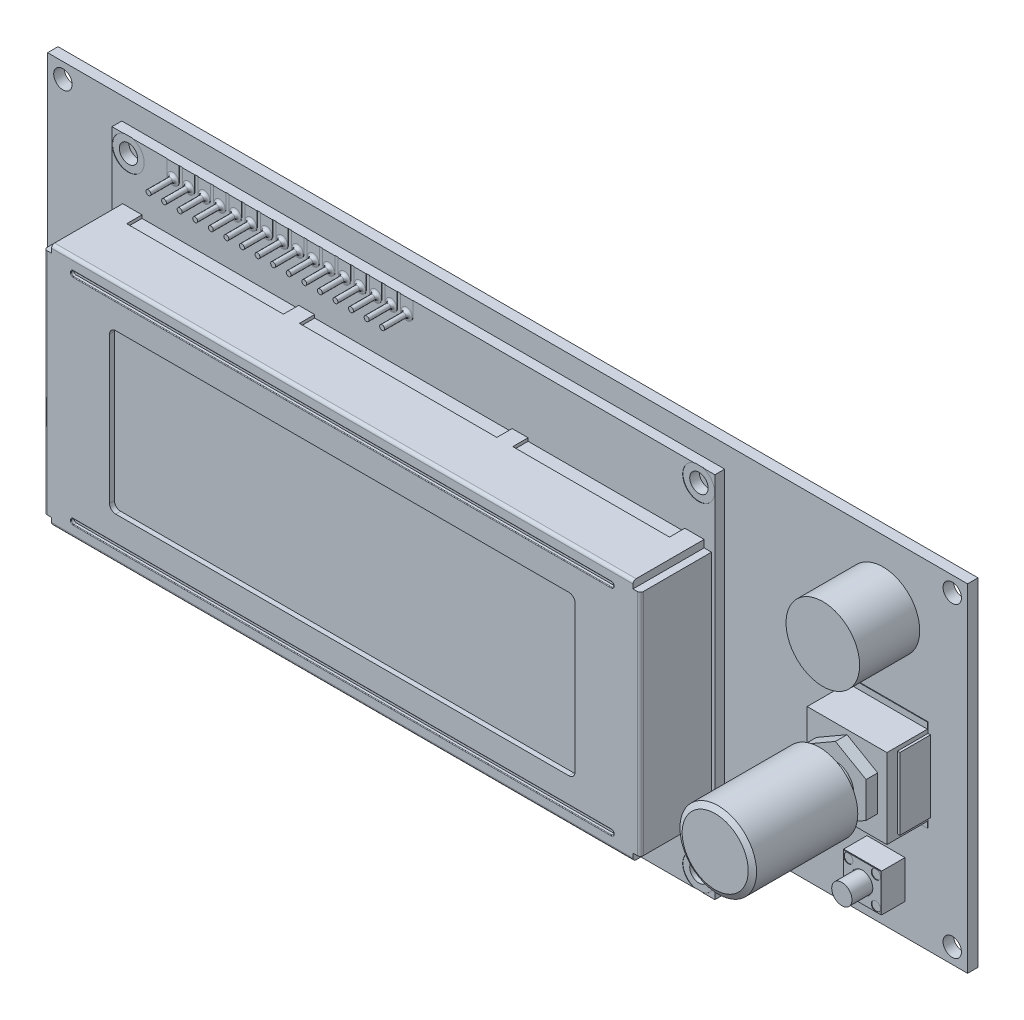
SolidWorks part; units mm, degrees
ref_plane "Front Plane" through (0, 0, 0) normal (0, 0, 1) x (1, 0, 0)
ref_plane "Top Plane" through (0, 0, 0) normal (0, 1, 0) x (1, 0, 0)
ref_plane "Right Plane" through (0, 0, 0) normal (1, 0, 0) x (0, 0, -1)
sketch "Sketch1" plane through (0, 0, 0) normal (0, 0, 1) x (1, 0, 0)
  line L1 (-75, 27.5) -> (75, 27.5)
  line L2 (-75, 27.5) -> (-75, -27.5)
  line L3 (-75, -27.5) -> (75, -27.5)
  line L4 (75, 27.5) -> (75, -27.5)
  line L5 (-75, 27.5) -> (75, -27.5) construction
  line L6 (-75, -27.5) -> (75, 27.5) construction
  point P0 (0, 0)
  dimension "D1" = 150
  dimension "D2" = 55
extrude "Boss-Extrude1" add sketch "Sketch1" against normal blind 1.7
sketch "Sketch2" plane through (0, 0, -1.7) normal (0, 0, -1) x (-1, 0, 0)
  line L1 (-72.5, 25) -> (72.5, 25) construction
  line L2 (-72.5, 25) -> (-72.5, -25) construction
  line L3 (-72.5, -25) -> (72.5, -25) construction
  line L4 (72.5, 25) -> (72.5, -25) construction
  line L5 (-72.5, 25) -> (72.5, -25) construction
  line L6 (-72.5, -25) -> (72.5, 25) construction
  circle A0 centre (-72.5, 25) radius 1.5
  circle A1 centre (72.5, 25) radius 1.5
  circle A2 centre (72.5, -25) radius 1.5
  circle A3 centre (-72.5, -25) radius 1.5
  point P0 (0, 0)
  dimension "D3" = 3
  dimension "D1" = 50
  dimension "D2" = 145
extrude "Cut-Extrude1" cut sketch "Sketch2" against normal through all
ref_plane "Plane1" through (0, 0, 2.5) normal (0, 0, 1) x (1, 0, 0)
sketch "Sketch4" plane through (0, 0, 2.5) normal (0, 0, 1) x (1, 0, 0)
  line L0 (-75, 27.5) -> (-75, -27.5) construction
  line L1 (-62, 24.8) -> (36.3, 24.8)
  line L2 (-62, 24.8) -> (-62, -35.2)
  line L3 (-62, -35.2) -> (36.3, -35.2)
  line L4 (36.3, 24.8) -> (36.3, -35.2)
  line L5 (75, 27.5) -> (-75, 27.5) construction
  dimension "D1" = 60
  dimension "D2" = 98.3
  dimension "D3" = 13
  dimension "D4" = 2.7
extrude "Boss-Extrude2" add sketch "Sketch4" against normal blind 1.6 separate body
sketch "Sketch3" plane through (0, 0, 0) normal (0, 0, 1) x (1, 0, 0)
  line L0 (-75, 27.5) -> (-75, -27.5) construction
  line L1 (-53, 22.75) -> (-12.6, 22.75)
  line L2 (-53, 22.75) -> (-53, 21.25)
  line L3 (-53, 21.25) -> (-12.6, 21.25)
  line L4 (-12.6, 22.75) -> (-12.6, 21.25)
  line L5 (75, 27.5) -> (-75, 27.5) construction
  line L6 (-53, 22) -> (-12.6, 22) construction
  dimension "D1" = 22
  dimension "D2" = 4.75
  dimension "D3" = 5.5
  dimension "D4" = 40.4
extrude "Boss-Extrude3" add sketch "Sketch3" along normal up to next
sketch "Sketch5" plane through (0, 0, 2.5) normal (0, 0, 1) x (1, 0, 0)
  line L0 (-59.35, -5.2) -> (-62, -5.2) construction
  line L1 (-59.35, 22.3) -> (33.65, 22.3) construction
  line L2 (-59.35, 22.3) -> (-59.35, -32.7) construction
  line L3 (-59.35, -32.7) -> (33.65, -32.7) construction
  line L4 (33.65, 22.3) -> (33.65, -32.7) construction
  line L5 (-62, 24.8) -> (-62, -35.2) construction
  line L6 (-12.85, 22.3) -> (-12.85, 24.8) construction
  line L7 (36.3, 24.8) -> (-62, 24.8) construction
  circle A0 centre (-59.35, 22.3) radius 1.5
  circle A1 centre (33.65, 22.3) radius 1.5
  circle A2 centre (33.65, -32.7) radius 1.5
  circle A3 centre (-59.35, -32.7) radius 1.5
  dimension "D3" = 3
  dimension "D1" = 55
  dimension "D2" = 93
extrude "Cut-Extrude2" cut sketch "Sketch5" against normal up to next
ref_plane "Plane2" through (0, 0, 14.1) normal (0, 0, -1) x (-1, 0, 0)
sketch "Sketch6" plane through (0, 0, 2.5) normal (0, 0, 1) x (1, 0, 0)
  line L0 (-12.85, 14.8) -> (-12.85, 24.8) construction
  line L1 (-61.45, 14.8) -> (35.75, 14.8) construction
  line L2 (-61.45, 14.8) -> (-61.45, -24.9) construction
  line L3 (-61.45, -24.9) -> (35.75, -24.9) construction
  line L4 (35.75, 14.8) -> (35.75, -24.9) construction
  line L5 (36.3, 24.8) -> (-62, 24.8) construction
  line L6 (-61.45, 13.6) -> (-60.25, 13.6)
  line L7 (-60.25, 13.6) -> (-60.25, 14.8)
  line L8 (-60.25, -24.9) -> (-60.25, -23.7)
  line L9 (-60.25, -23.7) -> (-61.45, -23.7)
  line L10 (34.55, -24.9) -> (34.55, -23.7)
  line L11 (34.55, -23.7) -> (35.75, -23.7)
  line L12 (35.75, 13.6) -> (34.55, 13.6)
  line L13 (34.55, 13.6) -> (34.55, 14.8)
  line L14 (35.75, 13.6) -> (35.75, -23.7)
  line L15 (34.55, -24.9) -> (-60.25, -24.9)
  line L16 (-61.45, -23.7) -> (-61.45, 13.6)
  line L17 (-60.25, 14.8) -> (34.55, 14.8)
  dimension "D1" = 97.2
  dimension "D2" = 39.7
  dimension "D3" = 10
  dimension "D4" = 1.2
extrude "Boss-Extrude4" add sketch "Sketch6" along normal up to surface (11.6 mm away)
sketch "Sketch7" plane through (0, 0, 14.1) normal (0, 0, 1) x (1, 0, 0)
  line L0 (-12.85, 7.9) -> (-12.85, 14.8) construction
  line L1 (-50.8, 7.9) -> (25.1, 7.9)
  line L2 (-50.8, 7.9) -> (-50.8, -18)
  line L3 (-50.8, -18) -> (25.1, -18)
  line L4 (25.1, 7.9) -> (25.1, -18)
  line L5 (34.55, 14.8) -> (-60.25, 14.8) construction
  line L6 (25.1, -5.05) -> (35.75, -5.05) construction
  line L7 (35.75, 13.6) -> (35.75, -23.7) construction
  dimension "D1" = 25.9
  dimension "D2" = 75.9
extrude "Cut-Extrude3" cut sketch "Sketch7" against normal blind 0.8
fillet "Fillet1" radius 1 4 edges at (25.1, -18, 13.7) (-50.8, 7.9, 13.7) (-50.8, -18, 13.7) (25.1, 7.9, 13.7)
fillet "Fillet2" radius 0.5 4 edges at (-61.45, -5.05, 14.1) (-12.85, -24.9, 14.1) (-12.85, 14.8, 14.1) (35.75, -5.05, 14.1)
sketch "Sketch8" plane through (0, 0, 14.1) normal (0, 0, 1) x (1, 0, 0)
  line L0 (-12.85, -22.95) -> (-12.85, -24.4) construction
  line L1 (-57.1, 12.85) -> (31.4, 12.85)
  line L2 (-57.1, 12.85) -> (-57.1, 12.05)
  line L3 (-57.1, 12.05) -> (31.4, 12.05)
  line L4 (31.4, 12.85) -> (31.4, 12.05)
  line L5 (-57.1, -22.15) -> (31.4, -22.15)
  line L6 (-57.1, -22.15) -> (-57.1, -22.95)
  line L7 (-57.1, -22.95) -> (31.4, -22.95)
  line L8 (31.4, -22.15) -> (31.4, -22.95)
  line L9 (-60.25, -24.4) -> (34.55, -24.4) construction
  line L10 (-12.85, 12.05) -> (-12.85, -22.15) construction
  line L11 (-12.85, -5.05) -> (25.1, -5.05) construction
  line L12 (25.1, -17) -> (25.1, 6.9) construction
  dimension "D1" = 0.8
  dimension "D2" = 88.5
  dimension "D3" = 35
extrude "Cut-Extrude4" cut sketch "Sketch8" against normal blind 0.5
fillet "Fillet3" radius 0.4 8 edges at (31.4, 12.05, 13.85) (31.4, 12.85, 13.85) (-57.1, 12.85, 13.85) (-57.1, 12.05, 13.85) (31.4, -22.95, 13.85) (31.4, -22.15, 13.85) (-57.1, -22.95, 13.85) (-57.1, -22.15, 13.85)
fillet "Fillet4" radius 0.1 12 edges at (31.2828, 12.7328, 14.1) (31.2828, 12.1672, 14.1) (-12.85, 12.05, 14.1) (-56.9828, 12.1672, 14.1) (-56.9828, 12.7328, 14.1) (31.2828, -22.2672, 14.1) (31.2828, -22.8328, 14.1) (-12.85, -22.95, 14.1) (-56.9828, -22.8328, 14.1) (-56.9828, -22.2672, 14.1) (-12.85, 12.85, 14.1) (-12.85, -22.15, 14.1)
sketch "Sketch9" plane through (0, -24.9, 0) normal (0, -1, 0) x (1, 0, 0)
  line L0 (-62, 2.5) -> (36.3, 2.5) construction
  line L1 (-57.1, 2.5) -> (-31.55, 2.5)
  line L2 (-57.1, 2.5) -> (-57.1, 5)
  line L3 (-57.1, 5) -> (-31.55, 5)
  line L4 (-31.55, 2.5) -> (-31.55, 5)
  line L5 (-12.85, 5) -> (-12.85, 13.6) construction
  line L6 (-28.95, 2.5) -> (3.25, 2.5)
  line L7 (-28.95, 2.5) -> (-28.95, 5)
  line L8 (-28.95, 5) -> (3.25, 5)
  line L9 (3.25, 2.5) -> (3.25, 5)
  line L10 (5.85, 2.5) -> (31.4, 2.5)
  line L11 (5.85, 2.5) -> (5.85, 5)
  line L12 (5.85, 5) -> (31.4, 5)
  line L13 (31.4, 2.5) -> (31.4, 5)
  line L14 (34.55, 13.6) -> (-60.25, 13.6) construction
  line L15 (3.25, 5) -> (5.85, 5) construction
  line L16 (-28.95, 5) -> (-31.55, 5) construction
  dimension "D1" = 2.5
  dimension "D2" = 32.2
  dimension "D3" = 25.55
  dimension "D4" = 88.5
extrude "Cut-Extrude5" cut sketch "Sketch9" against normal blind 0.5
ref_plane "Plane3" through (0, -5.05, 0) normal (0, 1, 0) x (1, 0, 0)
mirror "Mirror1" about plane through (0, -5.05, 0) normal (0, 1, 0) of "Cut-Extrude5"
sketch "Sketch10" plane through (0, 0, 2.5) normal (0, 0, 1) x (1, 0, 0)
  line L0 (-12.6, 22.75) -> (-53, 22.75) construction
  line L1 (-53, 24.8) -> (-51, 24.8) construction
  line L2 (-53, 24.8) -> (-53, 21.5) construction
  line L3 (-53, 21.5) -> (-51, 21.5) construction
  line L4 (-51, 24.8) -> (-51, 21.5) construction
  line L5 (-12.6, 21.25) -> (-12.6, 22.75) construction
  line L6 (-53, 22.75) -> (-53, 21.25) construction
  line L7 (-53, 21.25) -> (-12.6, 21.25) construction
  line L8 (-12.6, 22.75) -> (-53, 22.75) construction
  line L9 (-12.6, 21.25) -> (-12.6, 22.75) construction
  line L10 (-53, 22.75) -> (-53, 21.25) construction
  line L11 (-53, 21.25) -> (-12.6, 21.25) construction
  line L12 (36.3, 24.8) -> (-62, 24.8) construction
  line L13 (-52, 21.5) -> (-52, 24.8) construction
  line L14 (-62, 24.8) -> (-62, -35.2) construction
  line L15 (-51, 22.5) -> (-51, 24.8)
  line L16 (-51, 24.8) -> (-53, 24.8)
  line L17 (-53, 24.8) -> (-53, 22.5)
  arc A0 (-51, 22.5) -> (-53, 22.5) centre (-52, 22.5) cw
  dimension "D1" = 2
  dimension "D2" = 10
  dimension "D3" = 2.3
extrude "Boss-Extrude5" add sketch "Sketch10" along normal blind 0.05
sketch "Sketch11" plane through (0, 0, 2.55) normal (0, 0, 1) x (1, 0, 0)
  circle A0 centre (-52, 22.5) radius 0.4
  dimension "D1" = 0.8
extrude "Boss-Extrude6" add sketch "Sketch11" along normal blind 4
fillet "Fillet5" radius 0.5 1 edges at (-52.4, 22.5, 2.55)
pattern_linear "LPattern1" count 16 spacing 2.54 along (1, 0, 0) of "Boss-Extrude5", "Boss-Extrude6", "Fillet5"
sketch "Sketch12" plane through (0, 0, 2.5) normal (0, 0, 1) x (1, 0, 0)
  circle A0 centre (-59.35, 22.3) radius 2.6
  circle A1 centre (33.65, 22.3) radius 2.6
  circle A2 centre (33.65, -32.7) radius 2.6
  circle A3 centre (-59.35, -32.7) radius 2.6
  dimension "D1" = 5.2
extrude "Cut-Extrude7" cut sketch "Sketch12" against normal blind 0.05
sketch "Sketch13" plane through (0, 0, 0) normal (0, 0, 1) x (1, 0, 0)
  line L0 (75, 27.5) -> (-75, 27.5) construction
  line L1 (75, -27.5) -> (75, 27.5) construction
  circle A0 centre (61.2, 17) radius 6
  dimension "D1" = 12
  dimension "D2" = 10.5
  dimension "D3" = 13.8
extrude "Boss-Extrude8" add sketch "Sketch13" along normal blind 9.8
sketch "Sketch14" plane through (0, 0, 0) normal (0, 0, 1) x (1, 0, 0)
  line L1 (55.15, 3.15) -> (68.95, 3.15)
  line L2 (55.15, 3.15) -> (55.15, -8.55)
  line L3 (55.15, -8.55) -> (68.95, -8.55)
  line L4 (68.95, 3.15) -> (68.95, -8.55)
  line L6 (55.15, 3.15) -> (68.95, -8.55) construction
  line L7 (55.15, -8.55) -> (68.95, 3.15) construction
  line L8 (75, 27.5) -> (-75, 27.5) construction
  line L9 (75, -27.5) -> (75, 27.5) construction
  point P6 (62.05, -2.7)
  dimension "D1" = 13.8
  dimension "D2" = 12.95
  dimension "D3" = 30.2
  dimension "D4" = 11.7
extrude "Boss-Extrude9" add sketch "Sketch14" along normal blind 5
ref_plane "Plane4" through (62.05, 0, 0) normal (1, 0, 0) x (0, 0, -1)
sketch "Sketch15" plane through (62.05, 0, 0) normal (1, 0, 0) x (0, 0, -1)
  line L0 (0, 3.15) -> (-5, 3.15)
  line L1 (-5, 3.15) -> (0, 3.15) construction
  line L2 (-5, 3.15) -> (-5, -8.55)
  line L3 (-5, -8.55) -> (0, -8.55)
  line L4 (0, -8.55) -> (0, -10.2)
  line L5 (0, -27.5) -> (0, 27.5) construction
  line L6 (0, -10.2) -> (-0.1, -10.2)
  line L7 (-0.1, -10.2) -> (-0.1, -9.2)
  line L8 (-0.1, -9.2) -> (-6.7, -9.2)
  line L9 (-6.7, -9.2) -> (-6.7, 3.8)
  line L10 (-6.7, 3.8) -> (-0.1, 3.8)
  line L11 (-0.1, 3.8) -> (-0.1, 4.8)
  line L12 (-0.1, 4.8) -> (0, 4.8)
  line L13 (0, 4.8) -> (0, 3.15)
  line L14 (-6.7, -2.7) -> (-5, -2.7) construction
  line L15 (1.7, -27.5) -> (1.7, 27.5) construction
  dimension "D1" = 13
  dimension "D2" = 8.4
  dimension "D3" = 0.1
  dimension "D4" = 15
extrude "Boss-Extrude10" add sketch "Sketch15" against normal mid plane 13
sketch "Sketch16" plane through (0, 0, 6.7) normal (0, 0, 1) x (1, 0, 0)
  line L0 (55.55, 3.8) -> (68.55, -9.2) construction
  line L1 (67.05, -5.5868) -> (67.05, 0.1868)
  line L2 (67.05, 0.1868) -> (62.05, 3.0735)
  line L3 (62.05, 3.0735) -> (57.05, 0.1868)
  line L4 (57.05, 0.1868) -> (57.05, -5.5868)
  line L5 (57.05, -5.5868) -> (62.05, -8.4735)
  line L6 (62.05, -8.4735) -> (67.05, -5.5868)
  circle A0 centre (62.05, -2.7) radius 5 construction
  point P12 (62.05, -2.7)
  dimension "D1" = 10
extrude "Boss-Extrude11" add sketch "Sketch16" along normal blind 1.9
sketch "Sketch17" plane through (0, 0, 8.6) normal (0, 0, 1) x (1, 0, 0)
  line L0 (62.05, 3.0735) -> (62.05, -8.4735) construction
  circle A0 centre (62.05, -2.7) radius 3
  point P6 (62.05, -2.7)
  dimension "D1" = 6
extrude "Boss-Extrude12" add sketch "Sketch17" along normal blind 2.6
sketch "Sketch18" plane through (0, 0, 11.2) normal (0, 0, 1) x (1, 0, 0)
  circle A0 centre (62.05, -2.7) radius 6.25
  dimension "D1" = 12.5
extrude "Boss-Extrude13" add sketch "Sketch18" along normal blind 17
chamfer "Chamfer1" distance 0.5 angle 60 1 edges at (68.3, -2.7, 28.2)
sketch "Sketch19" plane through (0, 0, 0) normal (0, 0, 1) x (1, 0, 0)
  line L0 (-75, -27.5) -> (75, -27.5) construction
  line L1 (58.6, -16.25) -> (64.8, -16.25)
  line L2 (58.6, -16.25) -> (58.6, -22.45)
  line L3 (58.6, -22.45) -> (64.8, -22.45)
  line L4 (64.8, -16.25) -> (64.8, -22.45)
  line L5 (75, -27.5) -> (75, 27.5) construction
  dimension "D1" = 6.2
  dimension "D2" = 11.25
  dimension "D3" = 16.4
extrude "Boss-Extrude14" add sketch "Sketch19" along normal blind 3.8
sketch "Sketch21" plane through (0, 0, 3.8) normal (0, 0, 1) x (1, 0, 0)
  line L0 (58.6, -16.25) -> (64.8, -22.45) construction
  circle A0 centre (61.7, -19.35) radius 1.65
  point P6 (61.7, -19.35)
  dimension "D1" = 3.3
extrude "Boss-Extrude15" add sketch "Sketch21" along normal blind 3.4
sketch "Sketch22" plane through (0, 0, 3.8) normal (0, 0, 1) x (1, 0, 0)
  line L0 (64.8, -22.45) -> (64.8, -16.25) construction
  line L1 (59.45, -17.1) -> (63.95, -17.1) construction
  line L2 (59.45, -17.1) -> (59.45, -21.6) construction
  line L3 (59.45, -21.6) -> (63.95, -21.6) construction
  line L4 (63.95, -17.1) -> (63.95, -21.6) construction
  line L5 (59.45, -17.1) -> (63.95, -21.6) construction
  line L6 (59.45, -21.6) -> (63.95, -17.1) construction
  line L7 (58.65, -16.3) -> (64.75, -16.3)
  line L8 (58.65, -16.3) -> (58.65, -22.4)
  line L9 (58.65, -22.4) -> (64.75, -22.4)
  line L10 (64.75, -16.3) -> (64.75, -22.4)
  line L11 (58.65, -16.3) -> (64.75, -22.4) construction
  line L12 (58.65, -22.4) -> (64.75, -16.3) construction
  circle A0 centre (61.7, -19.35) radius 1.75
  circle A1 centre (61.7, -19.35) radius 1.65 construction
  circle A2 centre (59.45, -17.1) radius 0.75
  circle A3 centre (63.95, -17.1) radius 0.75
  circle A4 centre (63.95, -21.6) radius 0.75
  circle A5 centre (59.45, -21.6) radius 0.75
  dimension "D1" = 0.1
  dimension "D2" = 1.5
  dimension "D3" = 4.5
  dimension "D4" = 0.05
extrude "Boss-Extrude16" add sketch "Sketch22" along normal blind 0.1
sketch "Sketch23" plane through (0, 0, -1.7) normal (0, 0, -1) x (-1, 0, 0)
  line L0 (-14, -11.7) -> (-6.25, -11.7)
  line L1 (-14, -2.7) -> (6, -2.7)
  line L2 (-14, -2.7) -> (-14, -11.7)
  line L3 (-14, -11.7) -> (6, -11.7) construction
  line L4 (6, -2.7) -> (6, -11.7)
  line L5 (-6.25, -11.7) -> (-6.25, -4.7)
  line L6 (-6.25, -4.7) -> (-1.75, -4.7)
  line L7 (-1.75, -4.7) -> (-1.75, -11.7)
  line L8 (-1.75, -11.7) -> (6, -11.7)
  line L9 (-4, -4.7) -> (-4, -2.7) construction
  line L10 (-75, 27.5) -> (75, 27.5) construction
  line L11 (-75, -27.5) -> (-75, 27.5) construction
  dimension "D1" = 20
  dimension "D2" = 9
  dimension "D3" = 7
  dimension "D4" = 4.5
  dimension "D5" = 30.2
  dimension "D6" = 61
extrude "Boss-Extrude17" add sketch "Sketch23" along normal blind 9
sketch "Sketch24" plane through (0, 0, -1.7) normal (0, 0, -1) x (-1, 0, 0)
  line L0 (6, -2.7) -> (-14, -2.7) construction
  line L1 (-9.5, -2.7) -> (1.5, -2.7) construction
  line L2 (-9.5, -2.7) -> (-9.5, 2.5) construction
  line L3 (-9.5, 2.5) -> (1.5, 2.5) construction
  line L4 (1.5, -2.7) -> (1.5, 2.5) construction
  line L5 (-4, 2.5) -> (-4, -4.7) construction
  line L6 (-6.25, -4.7) -> (-1.75, -4.7) construction
  line L7 (-8.9, -0.1) -> (-6.9, -0.1) construction
  line L8 (-9.5, 2.5) -> (-8.9, 2.5)
  line L9 (-9.5, 2.5) -> (-9.5, -2.7)
  line L10 (-9.5, -2.7) -> (-8.9, -2.7)
  line L11 (-8.9, 2.5) -> (-8.9, -2.7)
  line L12 (-6.9, 2.5) -> (-6.3, 2.5)
  line L13 (-6.9, 2.5) -> (-6.9, -2.7)
  line L14 (-6.9, -2.7) -> (-6.3, -2.7)
  line L15 (-6.3, 2.5) -> (-6.3, -2.7)
  line L16 (-4.3, 2.5) -> (-3.7, 2.5)
  line L17 (-4.3, 2.5) -> (-4.3, -2.7)
  line L18 (-4.3, -2.7) -> (-3.7, -2.7)
  line L19 (-3.7, 2.5) -> (-3.7, -2.7)
  line L20 (-1.7, 2.5) -> (-1.1, 2.5)
  line L21 (-1.7, 2.5) -> (-1.7, -2.7)
  line L22 (-1.7, -2.7) -> (-1.1, -2.7)
  line L23 (-1.1, 2.5) -> (-1.1, -2.7)
  line L24 (1.5, 2.5) -> (0.9, 2.5)
  line L25 (1.5, 2.5) -> (1.5, -2.7)
  line L26 (1.5, -2.7) -> (0.9, -2.7)
  line L27 (0.9, 2.5) -> (0.9, -2.7)
  line L28 (-6.3, -0.1) -> (-4.3, -0.1) construction
  line L29 (-3.7, -0.1) -> (-1.7, -0.1) construction
  line L30 (-1.1, -0.1) -> (0.9, -0.1) construction
  point P10 (-4, 2.5)
  point P27 (-4, 2.5)
  dimension "D1" = 11
  dimension "D2" = 5.2
  dimension "D3" = 0.6
extrude "Boss-Extrude18" add sketch "Sketch24" along normal up to surface (9 mm away)
sketch "Sketch25" plane through (-1.5, 0, 0) normal (-1, 0, 0) x (0, 0, 1)
  line L0 (-7.1, -2.7) -> (-7.7, -2.7) construction
  line L1 (-1.7, -2.7) -> (-3.9, -2.7) construction
  line L2 (-1.7, -2.7) -> (-1.7, -0.5) construction
  line L3 (-1.7, -0.5) -> (-3.9, -0.5)
  line L4 (-3.9, -2.7) -> (-3.9, -0.5)
  line L5 (-1.7, 2.5) -> (-1.7, 1.9) construction
  line L6 (-1.7, -0.5) -> (-1.7, 1.9)
  line L7 (-1.7, 1.9) -> (-7.1, 1.9)
  line L8 (-7.1, -2.7) -> (-7.1, 1.9)
  line L9 (-4.4, 1.9) -> (-4.4, 2.5) construction
  line L10 (-7.1, 1.9) -> (-7.7, 1.9) construction
  line L11 (-1.7, 2.5) -> (-7.7, 2.5) construction
  line L12 (-7.7, -2.7) -> (-7.7, 2.5)
  line L13 (-3.9, -2.7) -> (-7.1, -2.7)
  line L14 (-10.7, -2.7) -> (-1.7, -2.7) construction
  line L15 (-1.7, 27.5) -> (-1.7, -27.5) construction
  line L16 (-10.7, -2.7) -> (-1.7, -2.7) construction
  line L17 (-7.7, 2.5) -> (-10.7, 2.5)
  line L18 (-10.7, 2.5) -> (-10.7, -2.7)
  line L19 (-10.7, -2.7) -> (-7.7, -2.7)
  line L20 (-2.5, -1.1) -> (-2.5, -0.5) construction
  line L21 (-1.7, -2.7) -> (-3.3, -2.7)
  line L22 (-1.7, -2.7) -> (-1.7, -1.1)
  line L23 (-1.7, -1.1) -> (-3.3, -1.1)
  line L24 (-3.3, -2.7) -> (-3.3, -1.1)
  line L25 (-3.3, -1.9) -> (-3.9, -1.9) construction
  line L26 (-10.7, 2.5) -> (-1.7, 2.5) construction
  line L27 (-10.7, -2.7) -> (-10.7, 2.5) construction
  dimension "D1" = 6
  dimension "D2" = 0.6
  dimension "D3" = 5.2
  dimension "D4" = 2.2
  dimension "D5" = 2.2
extrude "Cut-Extrude8" cut sketch "Sketch25" against normal through all
pattern_linear "LPattern2" count 2 spacing 23 along (-1, 0, 0) of "Boss-Extrude18", "Cut-Extrude8", "Boss-Extrude17"
sketch "Sketch26" plane through (0, 0, -1.7) normal (0, 0, -1) x (-1, 0, 0)
  circle A0 centre (52, 22.5) radius 0.4 construction
  circle A1 centre (49.46, 22.5) radius 0.4 construction
  circle A2 centre (46.92, 22.5) radius 0.4 construction
  circle A3 centre (44.38, 22.5) radius 0.4 construction
  circle A4 centre (41.84, 22.5) radius 0.4 construction
  circle A5 centre (39.3, 22.5) radius 0.4 construction
  circle A6 centre (36.76, 22.5) radius 0.4 construction
  circle A7 centre (34.22, 22.5) radius 0.4 construction
  circle A8 centre (31.68, 22.5) radius 0.4 construction
  circle A9 centre (29.14, 22.5) radius 0.4 construction
  circle A10 centre (26.6, 22.5) radius 0.4 construction
  circle A11 centre (24.06, 22.5) radius 0.4 construction
  circle A12 centre (21.52, 22.5) radius 0.4 construction
  circle A13 centre (18.98, 22.5) radius 0.4 construction
  circle A14 centre (16.44, 22.5) radius 0.4 construction
  circle A15 centre (13.9, 22.5) radius 0.4 construction
  circle A16 centre (52, 22.5) radius 0.4
  circle A17 centre (49.46, 22.5) radius 0.4
  circle A18 centre (46.92, 22.5) radius 0.4
  circle A19 centre (44.38, 22.5) radius 0.4
  circle A20 centre (41.84, 22.5) radius 0.4
  circle A21 centre (39.3, 22.5) radius 0.4
  circle A22 centre (36.76, 22.5) radius 0.4
  circle A23 centre (34.22, 22.5) radius 0.4
  circle A24 centre (31.68, 22.5) radius 0.4
  circle A25 centre (29.14, 22.5) radius 0.4
  circle A26 centre (26.6, 22.5) radius 0.4
  circle A27 centre (24.06, 22.5) radius 0.4
  circle A28 centre (21.52, 22.5) radius 0.4
  circle A29 centre (18.98, 22.5) radius 0.4
  circle A30 centre (16.44, 22.5) radius 0.4
  circle A31 centre (13.9, 22.5) radius 0.4
extrude "Boss-Extrude19" add sketch "Sketch26" along normal blind 1.6
fillet "Fillet6" radius 0.5 16 edges at (-49.06, 22.5, -1.7) (-46.52, 22.5, -1.7) (-43.98, 22.5, -1.7) (-41.44, 22.5, -1.7) (-38.9, 22.5, -1.7) (-36.36, 22.5, -1.7) (-33.82, 22.5, -1.7) (-31.28, 22.5, -1.7) (-28.74, 22.5, -1.7) (-26.2, 22.5, -1.7) (-23.66, 22.5, -1.7) (-21.12, 22.5, -1.7) (-18.58, 22.5, -1.7) (-16.04, 22.5, -1.7) (-13.5, 22.5, -1.7) (-51.6, 22.5, -1.7)
sketch "Sketch27" plane through (0, 0, -1.7) normal (0, 0, -1) x (-1, 0, 0)
  line L0 (75, 27.5) -> (75, -27.5) construction
  line L1 (48.4, 5.1) -> (75, 5.1) construction
  line L2 (48.4, 5.1) -> (48.4, -19.4)
  line L3 (48.4, -19.4) -> (75, -19.4)
  line L4 (75, 5.1) -> (75, -19.4)
  line L5 (48.4, 5.1) -> (53.8, 5.1)
  line L6 (53.8, 5.1) -> (55.7, 7)
  line L7 (55.7, 7) -> (75, 7)
  line L8 (75, 7) -> (75, 5.1)
  line L9 (75, -27.5) -> (-75, -27.5) construction
  dimension "D1" = 26.4
  dimension "D2" = 26.6
  dimension "D3" = 5.4
  dimension "D4" = 45
  dimension "D5" = 24.5
  dimension "D6" = 8.1
extrude "Boss-Extrude20" add sketch "Sketch27" along normal blind 3.1
sketch "Sketch28" plane through (-75, 0, 0) normal (-1, 0, 0) x (0, 0, 1)
  line L0 (-1.7, 27.5) -> (-1.7, 7) construction
  line L1 (-4.3, 5.8) -> (-1.7, 5.8)
  line L2 (-4.3, 5.8) -> (-4.3, -18.2)
  line L3 (-4.3, -18.2) -> (-1.7, -18.2)
  line L4 (-1.7, 5.8) -> (-1.7, -18.2)
  line L5 (-4.3, -6.2) -> (-4.8, -6.2) construction
  line L6 (-4.8, -19.4) -> (-4.8, 7) construction
  dimension "D1" = 2.6
  dimension "D2" = 24
extrude "Cut-Extrude9" cut sketch "Sketch28" against normal blind 20
sketch "Sketch29" plane through (0, 0, -1.7) normal (0, 0, -1) x (-1, 0, 0)
  line L0 (-65, 17.1) -> (-57.5, 17.1) construction
  line L1 (-68.5, 0.5) -> (-68.5, -5) construction
  line L2 (-64.5, -17.1) -> (-64.5, -21.7) construction
  line L3 (-64.5, -21.7) -> (-58, -21.7) construction
  line L4 (-58, -21.7) -> (-58, -17.1) construction
  line L5 (-58, -17.1) -> (-64.5, -17.1) construction
  line L6 (-55, 0.1) -> (-55, -2.4) construction
  line L7 (-55, -2.4) -> (-55, -4.9) construction
  line L8 (-75, 27.5) -> (75, 27.5) construction
  line L9 (-75, -27.5) -> (-75, 27.5) construction
  line L10 (75, -27.5) -> (-75, -27.5) construction
  circle A0 centre (-64.5, -21.7) radius 0.75
  circle A1 centre (-58, -21.7) radius 0.75
  circle A2 centre (-58, -17.1) radius 0.75
  circle A3 centre (-64.5, -17.1) radius 0.75
  circle A4 centre (-68.5, -5) radius 0.75
  circle A5 centre (-68.5, 0.5) radius 0.75
  circle A6 centre (-61.6, -9.5) radius 1.4
  circle A7 centre (-62, 4.5) radius 1.4
  circle A8 centre (-65, 17.1) radius 1.2
  circle A9 centre (-57.5, 17.1) radius 1.2
  circle A10 centre (-55, 0.1) radius 0.75
  circle A11 centre (-55, -2.4) radius 0.75
  circle A12 centre (-55, -4.9) radius 0.75
  dimension "D5" = 1.5
  dimension "D6" = 2.8
  dimension "D9" = 2.4
  dimension "D19" = 13.4
  dimension "D20" = 18
  dimension "D1" = 6.5
  dimension "D2" = 4.6
  dimension "D3" = 5
  dimension "D4" = 7.5
  dimension "D7" = 10.4
  dimension "D8" = 10
  dimension "D10" = 20
  dimension "D11" = 27.4
  dimension "D12" = 23
  dimension "D13" = 13
  dimension "D14" = 6.5
  dimension "D15" = 27
  dimension "D16" = 5.5
  dimension "D17" = 5.8
  dimension "D18" = 10.5
extrude "Boss-Extrude21" add sketch "Sketch29" along normal blind 1
chamfer "Chamfer2" distance 0.3 angle 60 13 edges at (57.25, -21.7, -2.7) (63.75, -21.7, -2.7) (63.75, -17.1, -2.7) (57.25, -17.1, -2.7) (60.2, -9.5, -2.7) (67.75, -5, -2.7) (54.25, -4.9, -2.7) (54.25, -2.4, -2.7) (54.25, 0.1, -2.7) (67.75, 0.5, -2.7) (60.6, 4.5, -2.7) (56.3, 17.1, -2.7) (63.8, 17.1, -2.7)
sketch "Sketch30" plane through (0, 0, -1.7) normal (0, 0, -1) x (-1, 0, 0)
  line L1 (35.2313, -3.9383) -> (39.5313, -3.9383)
  line L2 (35.2313, -3.9383) -> (35.2313, -13.9383)
  line L3 (35.2313, -13.9383) -> (39.5313, -13.9383)
  line L4 (39.5313, -3.9383) -> (39.5313, -13.9383)
  dimension "D1" = 10
  dimension "D2" = 4.3
extrude "Boss-Extrude22" add sketch "Sketch30" along normal blind 1.4
sketch "Sketch31" plane through (0, 0, -1.7) normal (0, 0, -1) x (-1, 0, 0)
  line L0 (39.5313, -13.9383) -> (39.5313, -3.9383) construction
  line L1 (39.5313, -4.8883) -> (41.2813, -4.8883)
  line L2 (39.5313, -4.8883) -> (39.5313, -4.1883)
  line L3 (39.5313, -4.1883) -> (41.2813, -4.1883)
  line L4 (41.2813, -4.8883) -> (41.2813, -4.1883)
  line L5 (39.5313, -13.9383) -> (39.5313, -3.9383) construction
  line L6 (39.5313, -5.4454) -> (41.2813, -5.4454)
  line L7 (39.5313, -5.4454) -> (39.5313, -6.1454)
  line L8 (39.5313, -6.1454) -> (41.2813, -6.1454)
  line L9 (41.2813, -5.4454) -> (41.2813, -6.1454)
  line L10 (41.2813, -4.8883) -> (41.2813, -5.4454) construction
  line L11 (39.5313, -7.4026) -> (41.2813, -7.4026)
  line L12 (39.5313, -7.4026) -> (39.5313, -6.7026)
  line L13 (39.5313, -6.7026) -> (41.2813, -6.7026)
  line L14 (41.2813, -7.4026) -> (41.2813, -6.7026)
  line L15 (39.5313, -7.9597) -> (41.2813, -7.9597)
  line L16 (39.5313, -7.9597) -> (39.5313, -8.6597)
  line L17 (39.5313, -8.6597) -> (41.2813, -8.6597)
  line L18 (41.2813, -7.9597) -> (41.2813, -8.6597)
  line L19 (39.5313, -9.2169) -> (41.2813, -9.2169)
  line L20 (39.5313, -9.2169) -> (39.5313, -9.9169)
  line L21 (39.5313, -9.9169) -> (41.2813, -9.9169)
  line L22 (41.2813, -9.2169) -> (41.2813, -9.9169)
  line L23 (39.5313, -10.474) -> (41.2813, -10.474)
  line L24 (39.5313, -10.474) -> (39.5313, -11.174)
  line L25 (39.5313, -11.174) -> (41.2813, -11.174)
  line L26 (41.2813, -10.474) -> (41.2813, -11.174)
  line L27 (39.5313, -11.7311) -> (41.2813, -11.7311)
  line L28 (39.5313, -11.7311) -> (39.5313, -12.4311)
  line L29 (39.5313, -12.4311) -> (41.2813, -12.4311)
  line L30 (41.2813, -11.7311) -> (41.2813, -12.4311)
  line L31 (39.5313, -12.9883) -> (41.2813, -12.9883)
  line L32 (39.5313, -12.9883) -> (39.5313, -13.6883)
  line L33 (39.5313, -13.6883) -> (41.2813, -13.6883)
  line L34 (41.2813, -12.9883) -> (41.2813, -13.6883)
  line L35 (41.2813, -6.1454) -> (41.2813, -6.7026) construction
  line L36 (41.2813, -7.4026) -> (41.2813, -7.9597) construction
  line L37 (41.2813, -9.2169) -> (41.2813, -8.6597) construction
  line L38 (41.2813, -9.9169) -> (41.2813, -10.474) construction
  line L39 (41.2813, -11.174) -> (41.2813, -11.7311) construction
  line L40 (41.2813, -12.4311) -> (41.2813, -12.9883) construction
  line L41 (39.5313, -8.9383) -> (41.2813, -8.9383) construction
  line L42 (41.2813, -5.1669) -> (37.3813, -5.1669) construction
  line L43 (37.3813, -5.1669) -> (37.3813, -3.9383) construction
  line L44 (39.5313, -3.9383) -> (35.2313, -3.9383) construction
  line L45 (37.3813, -5.1669) -> (33.4813, -5.1669) construction
  dimension "D1" = 9.5
  dimension "D2" = 0.7
  dimension "D3" = 7.8
extrude "Boss-Extrude23" add sketch "Sketch31" along normal blind 1
chamfer "Chamfer3" distance 1 angle 50 8 edges at (-41.2813, -4.5383, -2.7) (-41.2813, -5.7954, -2.7) (-41.2813, -7.0526, -2.7) (-41.2813, -8.3097, -2.7) (-41.2813, -9.5669, -2.7) (-41.2813, -10.824, -2.7) (-41.2813, -12.0811, -2.7) (-41.2813, -13.3383, -2.7)
ref_plane "Plane5" through (-37.3813, 0, 0) normal (-1, 0, 0) x (0, 0, 1)
mirror "Mirror2" about plane through (-37.3813, 0, 0) normal (-1, 0, 0) of "Boss-Extrude23", "Chamfer3"
sketch "Sketch34" plane through (0, 0, -1.7) normal (0, 0, -1) x (-1, 0, 0)
  line L0 (-75, 27.5) -> (75, 27.5) construction
  line L1 (-5, 13.7) -> (-3.6, 13.7)
  line L2 (-5, 13.7) -> (-5, 10.7)
  line L3 (-5, 10.7) -> (-3.6, 10.7)
  line L4 (-3.6, 13.7) -> (-3.6, 10.7)
  line L5 (-75, -27.5) -> (-75, 27.5) construction
  dimension "D1" = 1.4
  dimension "D2" = 3
  dimension "D3" = 13.8
  dimension "D4" = 70
extrude "Boss-Extrude24" add sketch "Sketch34" along normal blind 1.4
sketch "Sketch35" plane through (0, 0, -1.7) normal (0, 0, -1) x (-1, 0, 0)
  line L0 (-75, 27.5) -> (75, 27.5) construction
  line L1 (32.7, 14.9) -> (39.4, 14.9)
  line L2 (32.7, 14.9) -> (32.7, 11.5)
  line L3 (32.7, 11.5) -> (39.4, 11.5)
  line L4 (39.4, 14.9) -> (39.4, 11.5)
  line L5 (75, 27.5) -> (75, 7) construction
  dimension "D1" = 6.7
  dimension "D2" = 3.4
  dimension "D3" = 12.6
  dimension "D4" = 35.6
extrude "Boss-Extrude25" add sketch "Sketch35" along normal blind 2
sketch "Sketch36" plane through (0, 0, -1.7) normal (0, 0, -1) x (-1, 0, 0)
  line L0 (32.7, 11.5) -> (39.4, 11.5) construction
  line L1 (33.3, 11.5) -> (34.1, 11.5)
  line L2 (33.3, 11.5) -> (33.3, 10.3)
  line L3 (33.3, 10.3) -> (34.1, 10.3)
  line L4 (34.1, 11.5) -> (34.1, 10.3)
  line L5 (32.7, 11.5) -> (39.4, 11.5) construction
  line L6 (35.65, 11.5) -> (36.45, 11.5)
  line L7 (35.65, 11.5) -> (35.65, 10.3)
  line L8 (35.65, 10.3) -> (36.45, 10.3)
  line L9 (36.45, 11.5) -> (36.45, 10.3)
  line L10 (34.1, 10.3) -> (35.65, 10.3) construction
  line L11 (38, 11.5) -> (38.8, 11.5)
  line L12 (38, 11.5) -> (38, 10.3)
  line L13 (38, 10.3) -> (38.8, 10.3)
  line L14 (38.8, 11.5) -> (38.8, 10.3)
  line L15 (36.45, 10.3) -> (38, 10.3) construction
  line L16 (32.7, 11.5) -> (39.4, 14.9) construction
  line L17 (36.05, 13.2) -> (36.05, 11.5) construction
  line L18 (39.4, 14.9) -> (32.7, 14.9) construction
  line L19 (34.55, 14.9) -> (37.55, 14.9)
  line L20 (34.55, 14.9) -> (34.55, 16.9)
  line L21 (34.55, 16.9) -> (37.55, 16.9)
  line L22 (37.55, 14.9) -> (37.55, 16.9)
  point P28 (36.05, 16.9)
  dimension "D1" = 1.2
  dimension "D2" = 0.8
  dimension "D3" = 5.5
  dimension "D4" = 2
  dimension "D5" = 3
extrude "Boss-Extrude26" add sketch "Sketch36" along normal blind 1.5
chamfer "Chamfer4" distance 1 angle 50 4 edges at (-36.05, 16.9, -3.2) (-38.4, 10.3, -3.2) (-36.05, 10.3, -3.2) (-33.7, 10.3, -3.2)
sketch "Sketch37" plane through (0, 0, -1.7) normal (0, 0, -1) x (-1, 0, 0)
  line L0 (-75, 27.5) -> (75, 27.5) construction
  line L1 (3.4, 14.5) -> (5, 14.5)
  line L2 (3.4, 14.5) -> (3.4, 12.9)
  line L3 (3.4, 12.9) -> (5, 12.9)
  line L4 (5, 14.5) -> (5, 12.9)
  line L5 (14.9, 14.5) -> (16.5, 14.5)
  line L6 (14.9, 14.5) -> (14.9, 12.9)
  line L7 (14.9, 12.9) -> (16.5, 12.9)
  line L8 (16.5, 14.5) -> (16.5, 12.9)
  line L9 (42.9, 14.5) -> (44.5, 14.5)
  line L10 (42.9, 14.5) -> (42.9, 12.9)
  line L11 (42.9, 12.9) -> (44.5, 12.9)
  line L12 (44.5, 14.5) -> (44.5, 12.9)
  line L13 (43.4, -5) -> (45, -5)
  line L14 (43.4, -5) -> (43.4, -6.6)
  line L15 (43.4, -6.6) -> (45, -6.6)
  line L16 (45, -5) -> (45, -6.6)
  line L17 (75, 27.5) -> (75, 7) construction
  dimension "D1" = 1.6
  dimension "D2" = 13
  dimension "D3" = 30.5
  dimension "D4" = 30
  dimension "D5" = 32.5
  dimension "D6" = 58.5
  dimension "D7" = 70
extrude "Boss-Extrude27" add sketch "Sketch37" along normal blind 1
chamfer "Chamfer5" distance 0.5 angle 50 8 edges at (-4.2, 12.9, -1.7) (-4.2, 14.5, -1.7) (-15.7, 14.5, -1.7) (-15.7, 12.9, -1.7) (-44.2, -6.6, -1.7) (-44.2, -5, -1.7) (-43.7, 12.9, -1.7) (-43.7, 14.5, -1.7)
sketch "Sketch38" plane through (0, 0, -1.7) normal (0, 0, -1) x (-1, 0, 0)
  line L0 (-75, 27.5) -> (75, 27.5) construction
  line L1 (48.5, 14.8) -> (52.5, 14.8)
  line L2 (48.5, 14.8) -> (48.5, 11.6)
  line L3 (48.5, 11.6) -> (52.5, 11.6)
  line L4 (52.5, 14.8) -> (52.5, 11.6)
  line L5 (75, 27.5) -> (75, 7) construction
  dimension "D1" = 4
  dimension "D2" = 3.2
  dimension "D3" = 12.7
  dimension "D4" = 22.5
extrude "Boss-Extrude28" add sketch "Sketch38" along normal blind 1
sketch "Sketch39" plane through (0, 0, -2.7) normal (0, 0, -1) x (-1, 0, 0)
  line L1 (48.5, 14.8) -> (52.5, 11.6) construction
  line L2 (52.5, 14.8) -> (48.5, 14.8) construction
  circle A0 centre (50.5, 13.2) radius 1.6
  point P9 (50.5, 13.2)
extrude "Boss-Extrude29" add sketch "Sketch39" along normal blind 0.7
chamfer "Chamfer6" distance 0.5 angle 50 2 edges at (5, 12.2, -1.7) (3.6, 12.2, -1.7)
